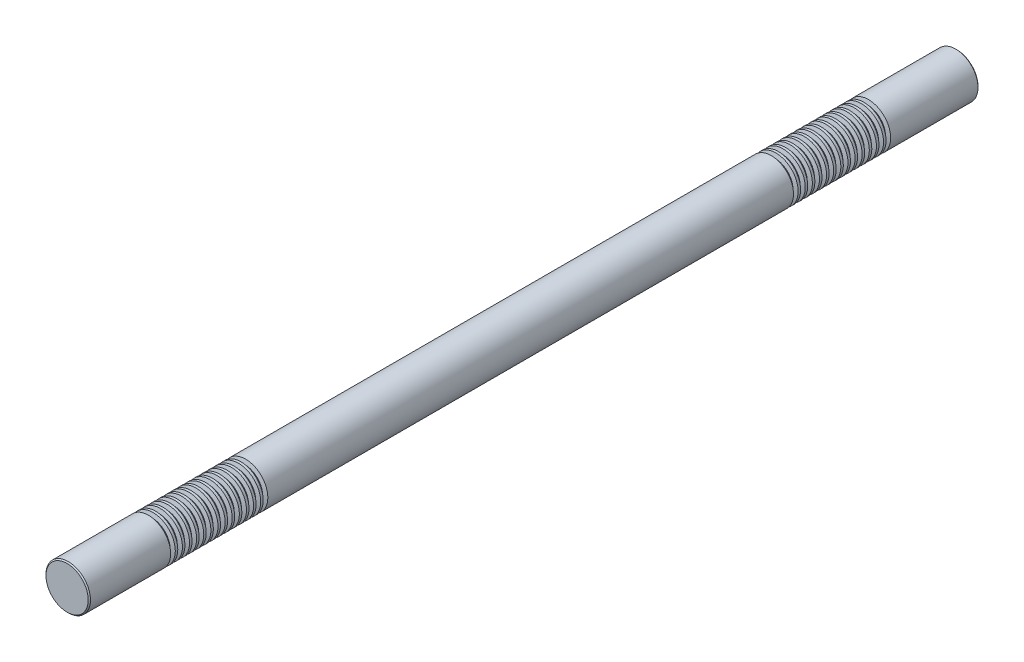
SolidWorks part; units mm, degrees
ref_plane "Front Plane" through (0, 0, 0) normal (0, 0, 1) x (1, 0, 0)
ref_plane "Top Plane" through (0, 0, 0) normal (0, 1, 0) x (1, 0, 0)
ref_plane "Right Plane" through (0, 0, 0) normal (1, 0, 0) x (0, 0, -1)
sketch "Sketch1" plane through (0, 0, 0) normal (0, 0, 1) x (1, 0, 0)
  circle A0 centre (0, 0) radius 25
  dimension "D1" = 50
extrude "Boss-Extrude1" add sketch "Sketch1" along normal mid plane 1000
chamfer "Chamfer1" distance 1.25 angle 45 2 edges at (25, 0, -500) (25, 0, 500)
sketch "Sketch2" plane through (0, 0, 0) normal (1, 0, 0) x (0, 0, -1)
  line L0 (400.6029, 25) -> (395.3971, 25)
  line L1 (498.75, 25) -> (-498.75, 25) construction
  line L2 (395.3971, 25) -> (396.6029, 20.5)
  line L3 (396.6029, 20.5) -> (399.3971, 20.5)
  line L4 (399.3971, 20.5) -> (400.6029, 25)
  line L5 (500, -23.75) -> (500, 23.75) construction
  point P4 (398, 25)
  point P7 (398, 20.5)
  point P8 (400, 22.75)
  point P9 (396, 22.75)
  dimension "D1" = 4
  dimension "D2" = 100
  dimension "D3" = 4.5
  dimension "D4" = 30
revolve "Cut-Revolve1" cut sketch "Sketch2" angle 360 about axis through (0, 0, 500) along (0, 0, -1)
pattern_linear "LPattern1" count 14 spacing 8 along (0, 0, 1) of "Cut-Revolve1"
pattern_linear "LPattern2" count 2 spacing 700 along (0, 0, 1) of "Cut-Revolve1", "LPattern1"
